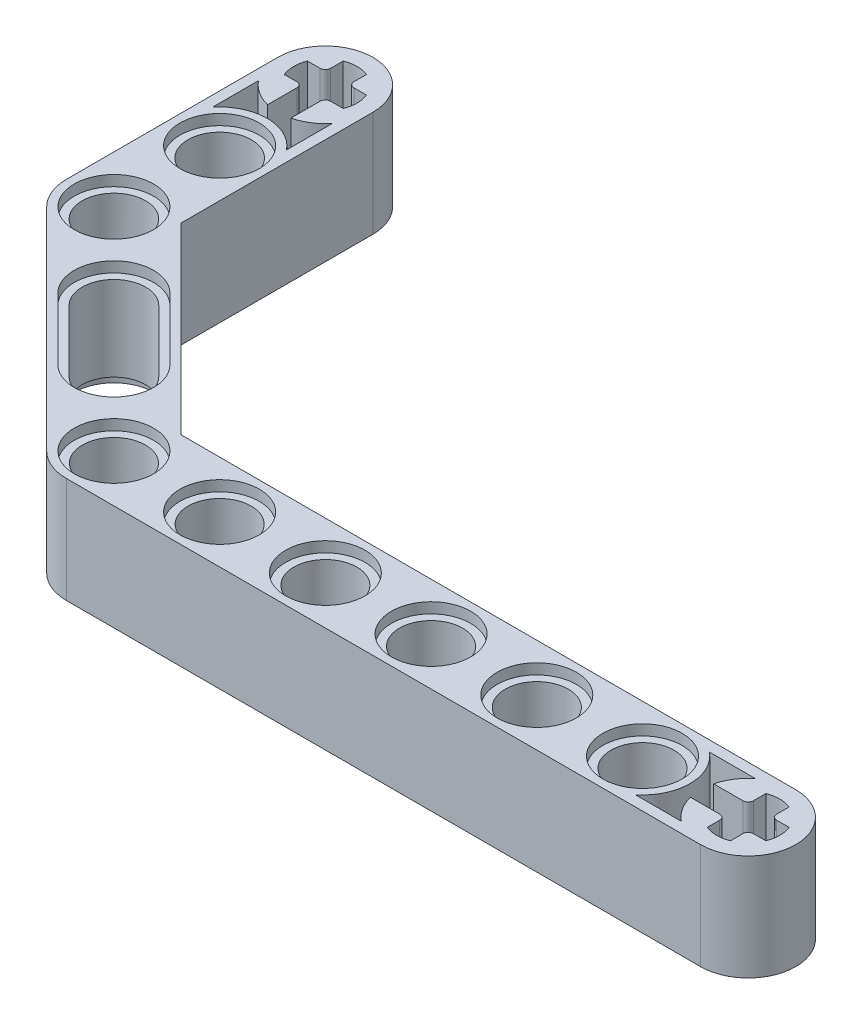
SolidWorks part; units mm, degrees
ref_plane "Front Plane" through (0, 0, 0) normal (0, 0, 1) x (1, 0, 0)
ref_plane "Top Plane" through (0, 0, 0) normal (0, 1, 0) x (1, 0, 0)
ref_plane "Right Plane" through (0, 0, 0) normal (1, 0, 0) x (0, 0, -1)
sketch "Sketch1" plane through (0, 0, 0) normal (0, 1, 0) x (1, 0, 0)
  line L0 (19.4218, 0) -> (-28.5782, 0) construction
  line L1 (-28.5782, 0) -> (-44.5782, 16) construction
  line L2 (-44.5782, 16) -> (-44.5782, 32) construction
  line L3 (-40.9782, 17.4912) -> (-27.087, 3.6)
  line L4 (19.4218, 3.6) -> (-27.087, 3.6)
  line L5 (19.4218, -3.6) -> (-28.5782, -3.6)
  line L6 (-47.1238, 13.4544) -> (-31.1238, -2.5456)
  line L7 (-48.1782, 32) -> (-48.1782, 16)
  line L8 (-40.9782, 32) -> (-40.9782, 17.4912)
  line L9 (-37.2243, 12.0402) -> (-32.538, 7.3539)
  line L10 (-40.6184, 8.6461) -> (-35.9321, 3.9598)
  line L11 (18.5418, 2.2168) -> (18.5418, 1.28)
  line L12 (20.3018, 2.2168) -> (20.3018, 1.28)
  line L13 (17.205, 0.88) -> (18.1418, 0.88)
  line L14 (21.6387, -0.88) -> (20.7018, -0.88)
  line L15 (20.7018, 0.88) -> (21.6387, 0.88)
  line L16 (18.5418, -1.28) -> (18.5418, -2.2168)
  line L17 (20.3018, -1.28) -> (20.3018, -2.2168)
  line L18 (18.1418, -0.88) -> (17.197, -0.88)
  line L19 (13.6846, 2.8) -> (17.1591, 2.8)
  line L20 (17.1591, -2.8) -> (13.6846, -2.8)
  line L21 (17.205, 0.88) -> (15.931, 0.88)
  line L22 (17.197, -0.88) -> (15.931, -0.88)
  line L23 (-45.4582, 34.2328) -> (-45.4582, 33.28)
  line L24 (-43.6982, 29.7672) -> (-43.6982, 30.72)
  line L25 (-42.3453, 32.88) -> (-43.2982, 32.88)
  line L26 (-46.811, 31.12) -> (-45.8582, 31.12)
  line L27 (-45.8582, 32.88) -> (-46.811, 32.88)
  line L28 (-45.4582, 30.72) -> (-45.4582, 29.7672)
  line L29 (-43.6982, 33.28) -> (-43.6982, 34.2328)
  line L30 (-43.2982, 31.12) -> (-42.3453, 31.12)
  line L31 (-47.3782, 29.7373) -> (-47.3782, 26.2627)
  line L32 (-41.7782, 26.2627) -> (-41.7782, 29.7373)
  line L33 (-45.4582, 29.7672) -> (-45.4582, 28.5092)
  line L34 (-43.6982, 29.7672) -> (-43.6982, 28.5092)
  arc A0 (18.5418, -2.2168) -> (20.3018, -2.2168) centre (19.4218, 0) ccw
  circle A1 centre (11.4218, 0) radius 2.3851
  circle A2 centre (3.4218, 0) radius 2.3851
  circle A3 centre (-4.5782, 0) radius 2.3851
  circle A4 centre (-12.5782, 0) radius 2.3851
  circle A5 centre (-20.5782, 0) radius 2.3851
  circle A6 centre (-28.5782, 0) radius 2.3851
  circle A7 centre (-44.5782, 16) radius 2.4
  arc A8 (-37.2243, 12.0402) -> (-40.6184, 8.6461) centre (-38.9213, 10.3431) ccw
  arc A9 (-35.9321, 3.9598) -> (-32.538, 7.3539) centre (-34.235, 5.6569) ccw
  arc A11 (-31.1238, -2.5456) -> (-28.5782, -3.6) centre (-28.5782, 0) ccw
  circle A12 centre (-44.5782, 24) radius 2.4
  arc A13 (-47.1238, 13.4544) -> (-48.1782, 16) centre (-44.5782, 16) cw
  arc A14 (-48.1782, 32) -> (-40.9782, 32) centre (-44.5782, 32) cw
  arc A15 (19.4218, 3.6) -> (19.4218, -3.6) centre (19.4218, 0) cw
  arc A16 (21.6387, -0.88) -> (21.6387, 0.88) centre (19.4218, 0) ccw
  arc A17 (20.3018, 2.2168) -> (18.5418, 2.2168) centre (19.4218, 0) ccw
  arc A19 (17.1591, 2.8) -> (15.931, 0.88) centre (19.4218, 0) ccw
  arc A20 (13.6846, -2.8) -> (13.6846, 2.8) centre (11.4218, 0) ccw
  arc A21 (15.931, -0.88) -> (17.1591, -2.8) centre (19.4218, 0) ccw
  arc A22 (-42.3453, 31.12) -> (-42.3453, 32.88) centre (-44.5782, 32) ccw
  arc A23 (-43.6982, 34.2328) -> (-45.4582, 34.2328) centre (-44.5782, 32) ccw
  arc A24 (-46.811, 32.88) -> (-46.811, 31.12) centre (-44.5782, 32) ccw
  arc A25 (-47.3782, 29.7373) -> (-45.4582, 28.5092) centre (-44.5782, 32) ccw
  arc A26 (-41.7782, 26.2627) -> (-47.3782, 26.2627) centre (-44.5782, 24) ccw
  arc A27 (-43.6982, 28.5092) -> (-41.7782, 29.7373) centre (-44.5782, 32) ccw
  arc A28 (-43.6982, 30.72) -> (-43.2982, 31.12) centre (-43.2982, 30.72) cw
  arc A29 (-43.2982, 32.88) -> (-43.6982, 33.28) centre (-43.2982, 33.28) cw
  arc A30 (-45.8582, 32.88) -> (-45.4582, 33.28) centre (-45.8582, 33.28) ccw
  arc A31 (-45.4582, 30.72) -> (-45.8582, 31.12) centre (-45.8582, 30.72) ccw
  arc A32 (18.5418, -1.28) -> (18.1418, -0.88) centre (18.1418, -1.28) ccw
  arc A33 (20.3018, -1.28) -> (20.7018, -0.88) centre (20.7018, -1.28) cw
  arc A34 (20.7018, 0.88) -> (20.3018, 1.28) centre (20.7018, 1.28) cw
  arc A35 (18.1418, 0.88) -> (18.5418, 1.28) centre (18.1418, 1.28) ccw
  point P80 (-43.6982, 31.12)
  point P83 (-43.6982, 32.88)
  point P90 (18.5418, -0.88)
  dimension "D5" = 7
  dimension "D6" = 8
  dimension "D7" = 8
  dimension "D8" = 3.6
  dimension "D14" = 3.6
  dimension "D29" = 0.4
  dimension "D1" = 48
  dimension "D2" = 16
  dimension "D3" = 135
  dimension "D4" = 16
  dimension "D9" = 3.6
  dimension "D10" = 7.2
  dimension "D11" = 7.2
  dimension "D12" = 3.6
  dimension "D13" = 7.2
  dimension "D15" = 2.4
  dimension "D16" = 2.4
  dimension "D17" = 0.88
  dimension "D18" = 1.76
  dimension "D19" = 0.88
  dimension "D20" = 1.76
  dimension "D21" = 0.8
  dimension "D22" = 0.8
  dimension "D23" = 0.88
  dimension "D24" = 1.76
  dimension "D25" = 0.88
  dimension "D26" = 1.76
  dimension "D27" = 0.8
  dimension "D28" = 0.8
extrude "Boss-Extrude1" add sketch "Sketch1" along normal blind 8
sketch "Sketch2" plane through (0, 8, 0) normal (0, 1, 0) x (1, 0, 0)
  line L0 (-36.8, 12.4645) -> (-32.1137, 7.7782)
  line L1 (-41.0426, 8.2218) -> (-36.3563, 3.5355)
  circle A0 centre (11.4218, 0) radius 3
  circle A1 centre (3.4218, 0) radius 3
  circle A2 centre (-4.5782, 0) radius 3
  circle A3 centre (-12.5782, 0) radius 3
  circle A4 centre (-20.5782, 0) radius 3
  circle A5 centre (-28.5782, 0) radius 3
  circle A6 centre (-44.5782, 24) radius 3
  circle A7 centre (-44.5782, 16) radius 3
  arc A8 (-36.8, 12.4645) -> (-41.0426, 8.2218) centre (-38.9213, 10.3431) ccw
  arc A9 (-36.3563, 3.5355) -> (-32.1137, 7.7782) centre (-34.235, 5.6569) ccw
  dimension "D1" = 3
  dimension "D2" = 3
extrude "Cut-Extrude1" cut sketch "Sketch2" against normal blind 0.8
ref_plane "Plane1" through (0, 4, 0) normal (0, 1, 0) x (1, 0, 0)
mirror "Mirror1" about plane through (0, 4, 0) normal (0, 1, 0) of "Cut-Extrude1"
